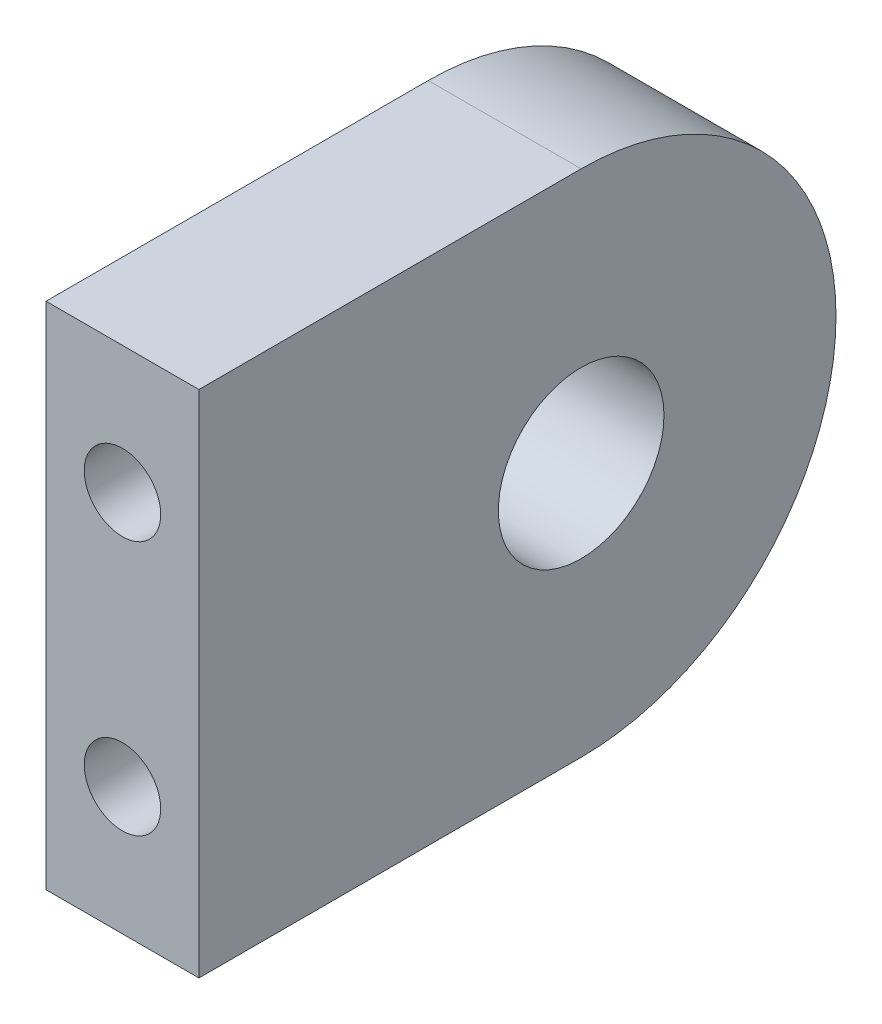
SolidWorks part; units mm, degrees
ref_plane "Front Plane" through (0, 0, 0) normal (0, 0, 1) x (1, 0, 0)
ref_plane "Top Plane" through (0, 0, 0) normal (0, 1, 0) x (1, 0, 0)
ref_plane "Right Plane" through (0, 0, 0) normal (1, 0, 0) x (0, 0, -1)
sketch "Sketch1" plane through (0, 0, 0) normal (1, 0, 0) x (0, 0, -1)
  line L0 (0, 0) -> (15, 0)
  line L1 (0, 0) -> (0, 20)
  line L2 (0, 20) -> (15, 20)
  line L3 (15, 20) -> (15, 0) construction
  arc A0 (15, 0) -> (15, 20) centre (15, 10) ccw
  circle A1 centre (15, 10) radius 3.25
  dimension "D1" = 6.5
  dimension "D2" = 20
  dimension "D3" = 15
extrude "Extrude1" add sketch "Sketch1" along normal blind 6
sketch "Sketch2" plane through (0, 0, 0) normal (0, 0, 1) x (1, 0, 0)
  line L0 (3, 20) -> (3, 0) construction
  line L1 (6, 20) -> (0, 20) construction
  line L2 (6, 0) -> (0, 0) construction
  point P6 (3, 15)
  point P7 (3, 5)
  dimension "D1" = 5
  dimension "D2" = 5
hole_wizard "M3 Tapped Hole1" positions "3DSketch1" profile "Sketch3" tap size "M3" standard "ISO"
sketch3d "3DSketch1"
  point P0 (3, 15, 0)
  point P3 (3, 5, 0)
sketch "Sketch3" plane through (3, 15, 0) normal (1, 0, 0) x (0, -1, 0)
  line L0 (0, 0) -> (0, 10.7511)
  line L1 (0, 10.7511) -> (1.25, 10)
  line L2 (1.25, 10) -> (1.25, 6)
  line L3 (1.25, 6) -> (1.5, 6)
  line L4 (1.5, 6) -> (1.5, 0)
  line L5 (1.5, 0) -> (0, 0)
  line L10 (0, 10.7511) -> (-1.25, 10) construction
  line L11 (0, -6.35) -> (0, 107.95) construction
  dimension "Tap Drill Dia." = 2.5
  dimension "Tap Drill Depth" = 10
  dimension "Thread Major Dia." = 3
  dimension "Thread Depth" = 6
  dimension "Drill Angle" = 118
